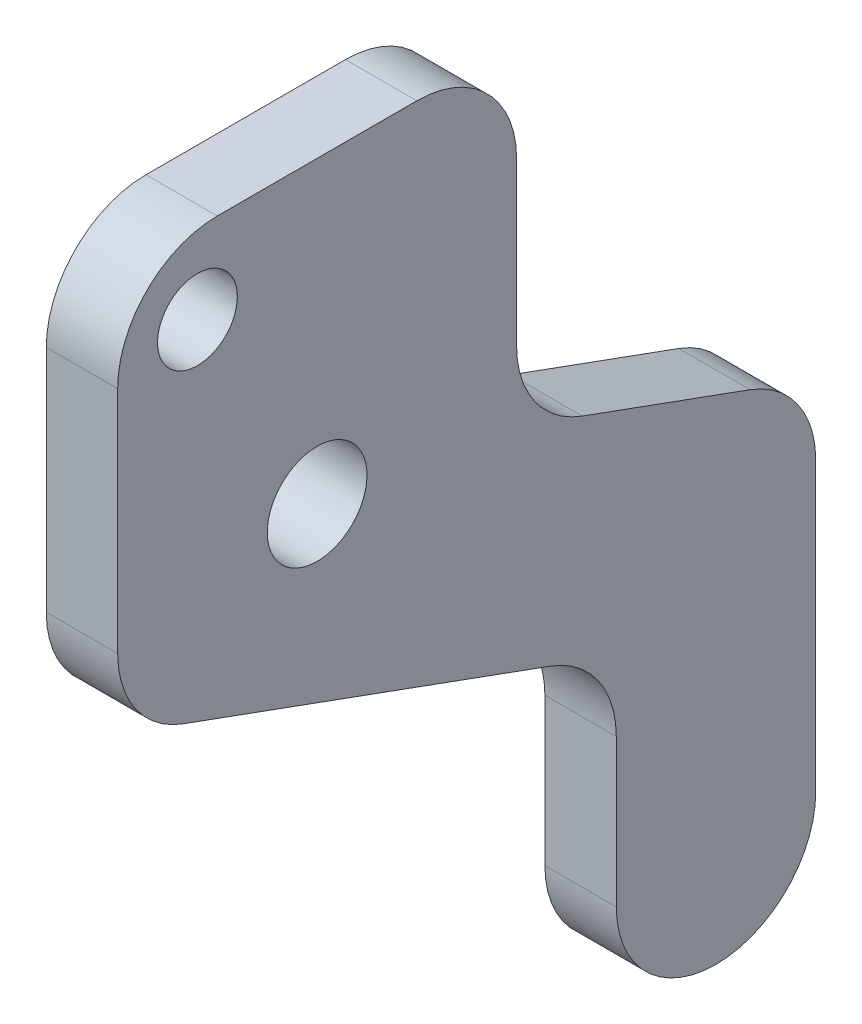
SolidWorks part; units mm, degrees
ref_plane "Front Plane" through (0, 0, 0) normal (0, 0, 1) x (1, 0, 0)
ref_plane "Top Plane" through (0, 0, 0) normal (0, 1, 0) x (1, 0, 0)
ref_plane "Right Plane" through (0, 0, 0) normal (1, 0, 0) x (0, 0, -1)
sketch "Sketch1" plane through (225.8314, 0, 0) normal (1, 0, 0) x (0, 0, -1)
  line L0 (1155.6784, 65.2929) -> (1155.6784, 39.8929)
  line L1 (1155.6784, 39.8929) -> (1187.4284, 28.3368)
  line L2 (1187.4284, 28.3368) -> (1187.4284, 8.1429)
  line L4 (1200.1284, 8.1429) -> (1200.1284, 37.2295)
  line L5 (1200.1284, 37.2295) -> (1181.0784, 44.1631)
  line L6 (1181.0784, 44.1631) -> (1181.0784, 65.2929)
  line L8 (1155.6784, 65.2929) -> (1181.0784, 65.2929)
  line L9 (1155.6784, 46.2429) -> (1168.3784, 46.2429) construction
  line L10 (1168.3784, 46.2429) -> (1181.0784, 46.2429) construction
  line L11 (1187.4284, 8.1429) -> (1200.1284, 8.1429)
  circle A0 centre (1168.3784, 46.2429) radius 3.175 construction
  circle A1 centre (1168.3784, 46.2429) radius 3.175
  dimension "D1" = 19.05
  dimension "D2" = 12.7
  dimension "D3" = 12.7
  dimension "D4" = 38.1
  dimension "D5" = 12.7
  dimension "D6" = 25.4
  dimension "D7" = 31.75
  dimension "D8" = 110
base flange "Base-Flange1" sketch "Sketch1" thickness 4.5466 reverse thickness direction yes parameters "D1"=3.5814
break corner "Break-Corner1" thickness 4.5466 parameters "D1"=6.35, "D0"=6.35, "D7"=5
sketch "Sketch6" plane through (230.378, 0, 0) normal (1, 0, 0) x (0, 0, -1)
  line L0 (1174.7284, 65.2929) -> (1162.0284, 65.2929) construction
  line L1 (1155.6784, 58.9429) -> (1155.6784, 44.3392) construction
  circle A0 centre (1160.7584, 60.2129) radius 2.54
  dimension "D1" = 5.08
  dimension "D2" = 5.08
  dimension "D3" = 5.08
extrude "Cut-Extrude1" cut sketch "Sketch6" against normal through all
sketch "Bend-Lines1" [suppressed] plane through (0, 0, 0) normal (0, 1, 0) x (1, 0, 0)
sketch "Bounding-Box1" [suppressed] plane through (0, 0, 0) normal (0, 1, 0) x (1, 0, 0)
sheet metal parameters "Sheet-Metal1" thickness 4.5466 parameters "D1"=3.5814
flat pattern "Flat-Pattern1"
sketch "Bend-Lines2" plane through (0, 0, 0) normal (0, 1, 0) x (1, 0, 0)
sketch3d "Bounding-Box2" [suppressed]
  line L0 (-1158.8672, 73.3742, 0) -> (-1207.8085, 37.1555, 0) construction
  line L1 (-1139.8355, 47.6571, 0) -> (-1188.7768, 11.4384, 0) construction
  line L2 (-1158.8672, 73.3742, 0) -> (-1139.8355, 47.6571, 0) construction
  line L3 (-1207.8085, 37.1555, 0) -> (-1188.7768, 11.4384, 0) construction
sheet metal parameters "Sheet-Metal2" thickness 4.5466 parameters "D1"=3.5814
flat pattern "Flat-Pattern1"
sketch "Bend-Lines2" plane through (0, 0, 0) normal (0, 1, 0) x (1, 0, 0)
sketch3d "Bounding-Box2" [suppressed]
  line L0 (-1167.7089, 74.2567, 0) -> (-1216.0002, 28.861, 0) construction
  line L1 (-1145.7646, 50.9127, 0) -> (-1194.0559, 5.517, 0) construction
  line L2 (-1167.7089, 74.2567, 0) -> (-1145.7646, 50.9127, 0) construction
  line L3 (-1216.0002, 28.861, 0) -> (-1194.0559, 5.517, 0) construction
